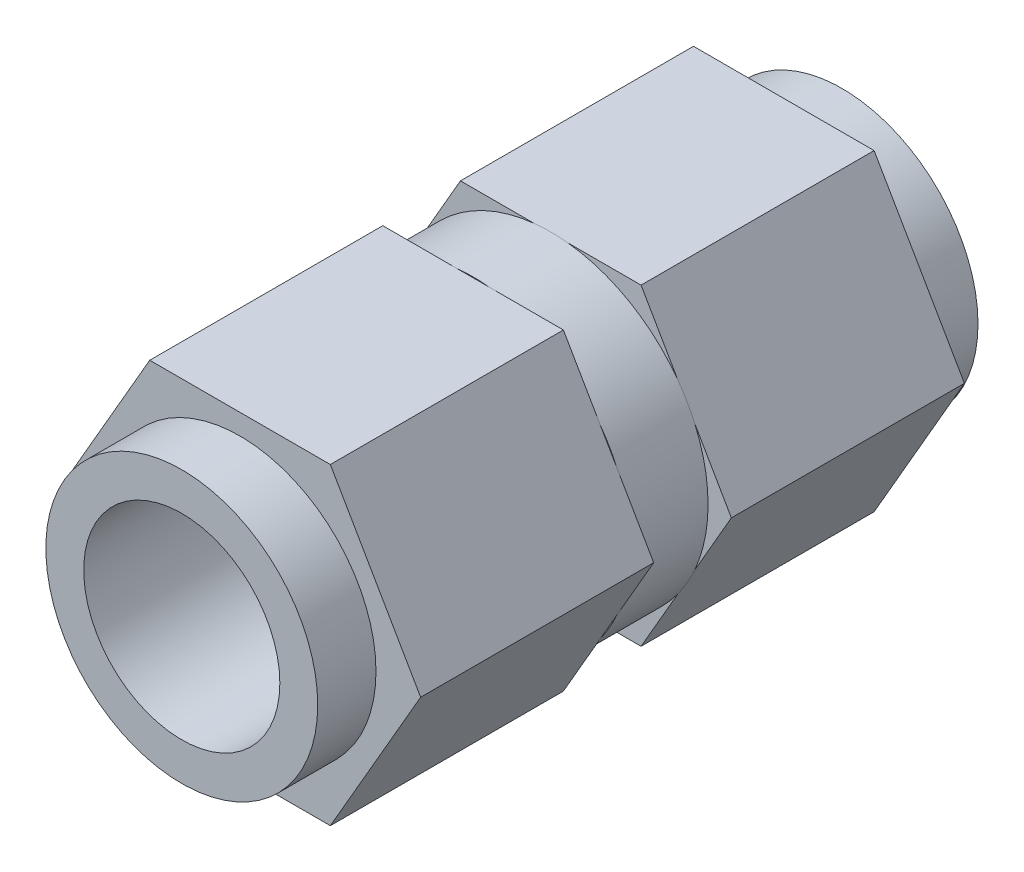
SolidWorks part; units mm, degrees
ref_plane "Front Plane" through (0, 0, 0) normal (0, 0, 1) x (1, 0, 0)
ref_plane "Top Plane" through (0, 0, 0) normal (0, 1, 0) x (1, 0, 0)
ref_plane "Right Plane" through (0, 0, 0) normal (1, 0, 0) x (0, 0, -1)
sketch "Sketch1" plane through (0, 0, 0) normal (0, 0, 1) x (1, 0, 0)
  line L1 (4.65, 0) -> (2.325, 4.027)
  line L2 (2.325, 4.027) -> (-2.325, 4.027)
  line L3 (-2.325, 4.027) -> (-4.65, 0)
  line L4 (-4.65, 0) -> (-2.325, -4.027)
  line L5 (-2.325, -4.027) -> (2.325, -4.027)
  line L6 (2.325, -4.027) -> (4.65, 0)
  circle A0 centre (0, 0) radius 4.027 construction
  dimension "D1" = 9.3
extrude "Boss-Extrude1" add sketch "Sketch1" along normal blind 6
sketch "Sketch2" plane through (0, 0, 6) normal (0, 0, 1) x (1, 0, 0)
  circle A0 centre (0, 0) radius 4.05
  dimension "D1" = 8.1
extrude "Boss-Extrude2" add sketch "Sketch2" along normal blind 2
sketch "Sketch3" plane through (0, 0, 8) normal (0, 0, 1) x (1, 0, 0)
  line L1 (4.65, 0) -> (2.325, 4.027)
  line L2 (2.325, 4.027) -> (-2.325, 4.027)
  line L3 (-2.325, 4.027) -> (-4.65, 0)
  line L4 (-4.65, 0) -> (-2.325, -4.027)
  line L5 (-2.325, -4.027) -> (2.325, -4.027)
  line L6 (2.325, -4.027) -> (4.65, 0)
  circle A0 centre (0, 0) radius 4.027 construction
  dimension "D1" = 9.3
extrude "Boss-Extrude3" add sketch "Sketch3" along normal blind 6
sketch "Sketch5" plane through (0, 0, 0) normal (0, 0, -1) x (-1, 0, 0)
  circle A0 centre (0, 0) radius 3.5
  dimension "D1" = 7
extrude "Boss-Extrude4" add sketch "Sketch5" along normal blind 1.5
sketch "Sketch6" plane through (0, 0, -1.5) normal (0, 0, -1) x (-1, 0, 0)
  circle A0 centre (0, 0) radius 2
  dimension "D1" = 4
extrude "Cut-Extrude2" cut sketch "Sketch6" against normal blind 1
sketch "Sketch7" plane through (0, 0, -0.5) normal (0, 0, -1) x (-1, 0, 0)
  circle A0 centre (0, 0) radius 0.75
  dimension "D1" = 1.5
extrude "Cut-Extrude3" cut sketch "Sketch7" against normal blind 1.5
sketch "Sketch9" plane through (0, 0, 14) normal (0, 0, 1) x (1, 0, 0)
  circle A0 centre (0, 0) radius 3.5
  dimension "D1" = 7
extrude "Boss-Extrude6" add sketch "Sketch9" along normal blind 1.5
sketch "Sketch10" plane through (0, 0, 15.5) normal (0, 0, 1) x (1, 0, 0)
  circle A0 centre (0, 0) radius 2.525
  dimension "D1" = 5.05
extrude "Cut-Extrude4" cut sketch "Sketch10" against normal blind 15
sketch "Sketch11" plane through (0, 0, 0) normal (1, 0, 0) x (0, 0, -1)
  line L0 (-883.4, -12.9) -> (844.6, -12.9) construction
